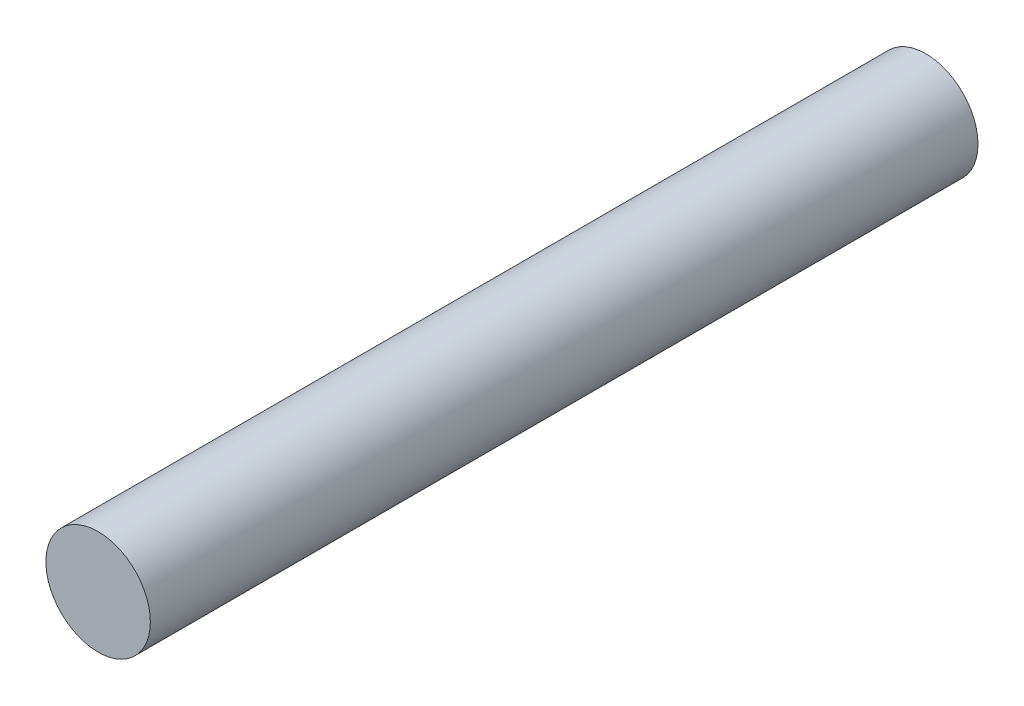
SolidWorks part; units mm, degrees
ref_plane "Front Plane" through (0, 0, 0) normal (0, 0, 1) x (1, 0, 0)
ref_plane "Top Plane" through (0, 0, 0) normal (0, 1, 0) x (1, 0, 0)
ref_plane "Right Plane" through (0, 0, 0) normal (1, 0, 0) x (0, 0, -1)
sketch "Sketch1" plane through (0, 0, 0) normal (0, 0, 1) x (1, 0, 0)
  circle A0 centre (0, 0) radius 2
  dimension "D1" = 4
extrude "Boss-Extrude1" add sketch "Sketch1" along normal mid plane 31.7
